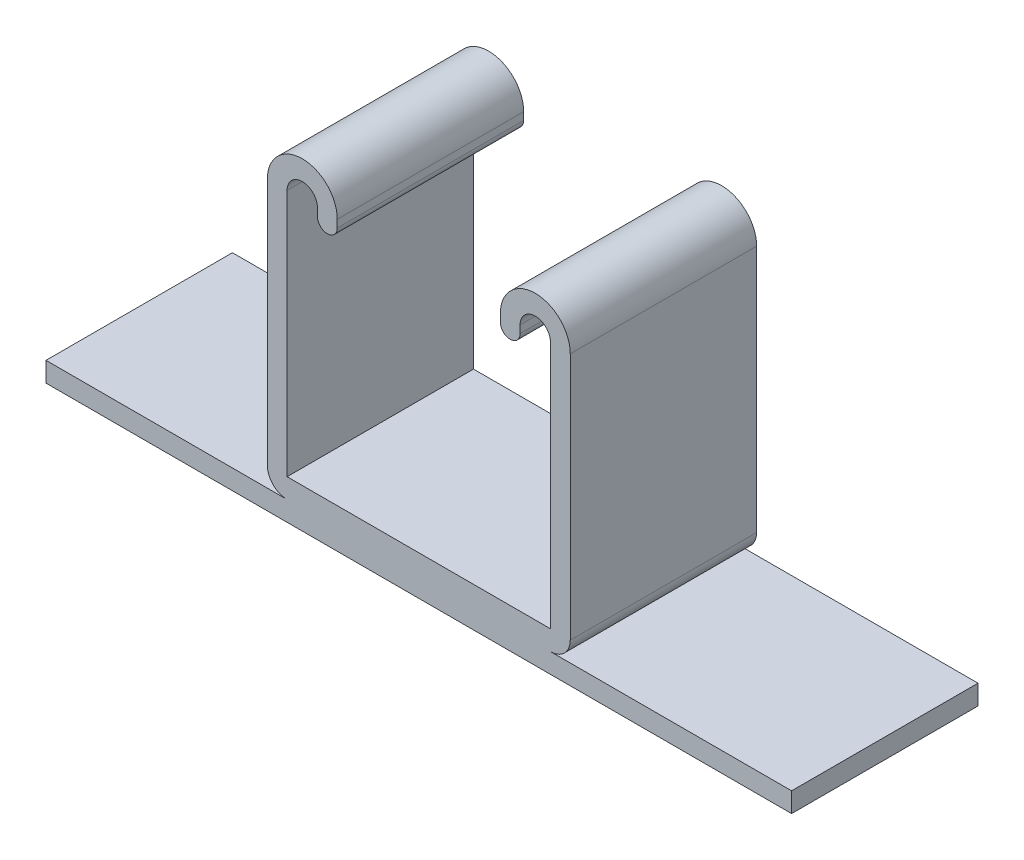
SolidWorks part; units mm, degrees
ref_plane "Plane1" through (0, 0, 0) normal (0, 0, 1) x (1, 0, 0)
ref_plane "Plane2" through (0, 0, 0) normal (0, 1, 0) x (1, 0, 0)
ref_plane "Plane3" through (0, 0, 0) normal (1, 0, 0) x (0, 0, -1)
sketch "Sketch1" plane through (0, 0, 0) normal (0, 0, 1) x (1, 0, 0)
  line L0 (-20.6375, 26.8351) -> (-20.6375, -6.9596)
  line L2 (20.6375, -6.9596) -> (20.6375, 26.8351)
  line L3 (11.1125, 26.8351) -> (11.1125, 25.8)
  line L4 (-11.1125, 26.8351) -> (-11.1125, 25.8)
  line L5 (-13.8049, 26.8351) -> (-13.8049, 25.8)
  line L6 (-17.9451, 26.8351) -> (-17.9451, -6.9596)
  line L7 (-17.9451, -6.9596) -> (17.9451, -6.9596)
  line L8 (17.9451, -6.9596) -> (17.9451, 26.8351)
  line L9 (13.8049, 26.8351) -> (13.8049, 25.8)
  line L10 (-25.4, 31.5976) -> (25.4, 31.5976) construction
  line L11 (-12.8524, 24.4538) -> (12.8524, 24.4538) construction
  line L12 (17.9451, -9.652) -> (50.8, -9.652)
  line L13 (50.8, -9.652) -> (50.8, -12.3444)
  line L14 (50.8, -12.3444) -> (-50.8, -12.3444)
  line L15 (-50.8, -12.3444) -> (-50.8, -9.652)
  line L16 (-50.8, -9.652) -> (-17.9451, -9.652)
  arc A0 (20.6375, 26.8351) -> (11.1125, 26.8351) centre (15.875, 26.8351) ccw
  arc A1 (-20.6375, 26.8351) -> (-11.1125, 26.8351) centre (-15.875, 26.8351) cw
  arc A2 (-17.9451, -9.652) -> (-20.6375, -6.9596) centre (-17.9451, -6.9596) cw
  arc A3 (17.9451, -9.652) -> (20.6375, -6.9596) centre (17.9451, -6.9596) ccw
  arc A4 (-17.9451, 26.8351) -> (-13.8049, 26.8351) centre (-15.875, 26.8351) cw
  arc A5 (17.9451, 26.8351) -> (13.8049, 26.8351) centre (15.875, 26.8351) ccw
  arc A6 (11.1125, 25.8) -> (13.8049, 25.8) centre (12.4587, 25.8) ccw
  arc A7 (-11.1125, 25.8) -> (-13.8049, 25.8) centre (-12.4587, 25.8) cw
  dimension "D1" = 2.6924
  dimension "D3" = 20.6375
  dimension "D4" = 2.6924
  dimension "Width" = 41.275
  dimension "D5" = 2.6924
  dimension "D6" = 9.525
  dimension "D7" = 22.225
  dimension "D8" = 31.5976
  dimension "D9" = 7.1437
  dimension "D2" = 12.3444
  dimension "D10" = 50.8
  dimension "D11" = 101.6
  dimension "gauge" = 2.6924
extrude "Base-Extrude" add sketch "Sketch1" along normal mid plane 25.4
equation "\"D3@Sketch1\" = \"Width@Sketch1\" / 2"
equation "\"D7@Sketch1\" = \"Width@Sketch1\" - 2 * \"D6@Sketch1\""
equation "\"D1@Sketch1\" = \"gauge@Sketch1\""
